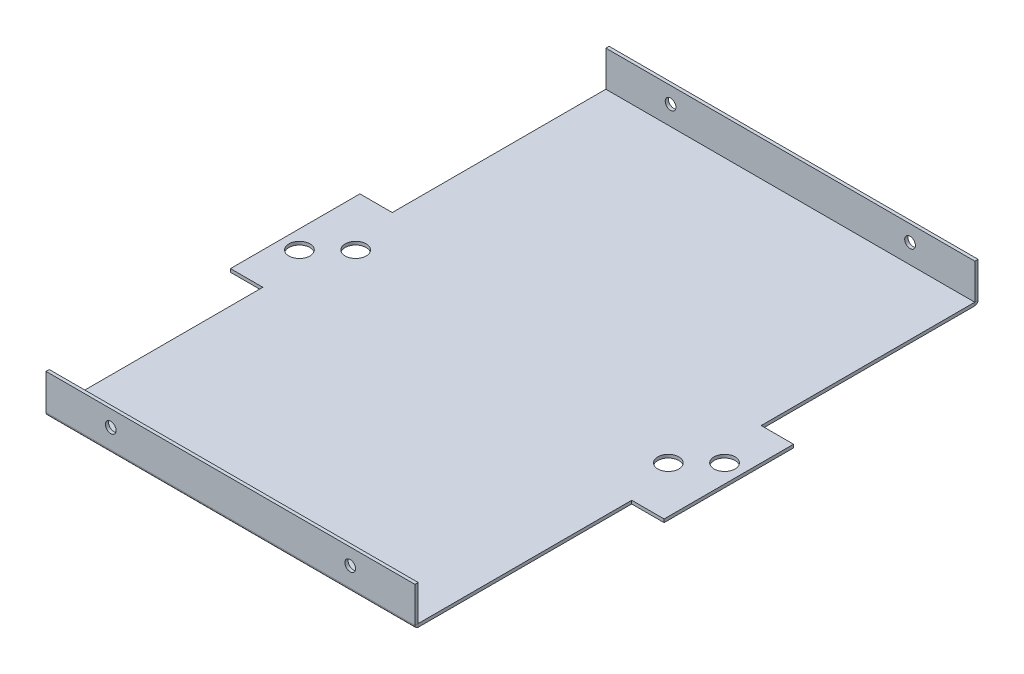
SolidWorks part; units mm, degrees
ref_plane "Front Plane" through (0, 0, 0) normal (0, 0, 1) x (1, 0, 0)
ref_plane "Top Plane" through (0, 0, 0) normal (0, 1, 0) x (1, 0, 0)
ref_plane "Right Plane" through (0, 0, 0) normal (1, 0, 0) x (0, 0, -1)
sketch "Sketch1" plane through (0, 0, 0) normal (0, 1, 0) x (1, 0, 0)
  line L0 (0, 189) -> (114, 189) construction
  line L1 (0, 0) -> (114, 0)
  line L2 (0, 0) -> (0, 77)
  line L3 (0, 194) -> (114, 194)
  line L4 (114, 0) -> (114, 77)
  line L5 (114, 5) -> (0, 5) construction
  line L6 (124, 97) -> (-10, 97) construction
  line L7 (114, 97) -> (104, 97) construction
  line L8 (-10, 107) -> (10, 107) construction
  line L10 (-10, 87) -> (10, 87) construction
  line L11 (10, 107) -> (10, 87) construction
  line L12 (104, 107) -> (124, 107) construction
  line L13 (104, 107) -> (104, 87) construction
  line L14 (104, 87) -> (124, 87) construction
  line L16 (10, 97) -> (0, 97) construction
  line L17 (124, 107) -> (104, 87) construction
  line L18 (-10, 117) -> (0, 117)
  line L19 (124, 117) -> (124, 77)
  line L20 (10, 107) -> (-10, 87) construction
  line L21 (124, 77) -> (114, 77)
  line L22 (-10, 77) -> (-10, 117)
  line L23 (114, 117) -> (124, 117)
  line L24 (0, 77) -> (-10, 77)
  line L25 (114, 117) -> (114, 194)
  line L27 (0, 117) -> (0, 194)
  circle A0 centre (94, 189) radius 1.65
  circle A1 centre (20, 189) radius 1.65
  circle A2 centre (20, 5) radius 1.65
  circle A3 centre (94, 5) radius 1.65
  circle A4 centre (118.3431, 101.3431) radius 3.25
  circle A5 centre (109.6569, 92.6569) radius 3.25
  circle A6 centre (4.3431, 101.3431) radius 3.25
  circle A7 centre (-4.3431, 92.6569) radius 3.25
  dimension "D5" = 3.3
  dimension "D6" = 20
  dimension "D7" = 20
  dimension "D8" = 20
  dimension "D9" = 20
  dimension "D11" = 6.5
  dimension "D12" = 8
  dimension "D13" = 8
  dimension "D14" = 8
  dimension "D15" = 8
  dimension "D1" = 194
  dimension "D2" = 114
  dimension "D3" = 5
  dimension "D4" = 5
  dimension "D10" = 20
  dimension "D16" = 20
  dimension "D17" = 20
  dimension "D18" = 10
  dimension "D19" = 10
  dimension "D20" = 10
  dimension "D21" = 10
  dimension "D22" = 20
sheet metal parameters "Sheet-Metal1" thickness 1 parameters "D1"=0.0001
base flange "Base-Flange1" sketch "Sketch1" thickness 1 reverse thickness direction yes parameters "D1"=0.0001
sketch "Sketch3" plane through (0, 1, 0) normal (0, 1, 0) x (1, 0, 0)
  line L0 (0, 184) -> (114, 184)
  line L1 (0, 77) -> (0, 0) construction
  line L2 (114, 0) -> (114, 77) construction
  line L3 (0, 10) -> (114, 10)
  line L4 (114, 194) -> (0, 194) construction
  line L5 (0, 0) -> (114, 0) construction
  dimension "D1" = 10
  dimension "D2" = 10
sketched bend "Sketched Bend1" parameters "D1"=0
bend "SketchBend1" bend radius 0.0001 bend angle 90 parameters "D5"=1
bend "SketchBend2" bend radius 0 bend angle 90 parameters "D5"=2
flat pattern "Flat-Pattern1"
sketch "Bend-Lines1" plane through (0, 0, 0) normal (0, 1, 0) x (-1, 0, 0)
bend of the flat pattern "Flatten-<SketchBend1>1"
bend of the flat pattern "Flatten-<SketchBend2>1"
